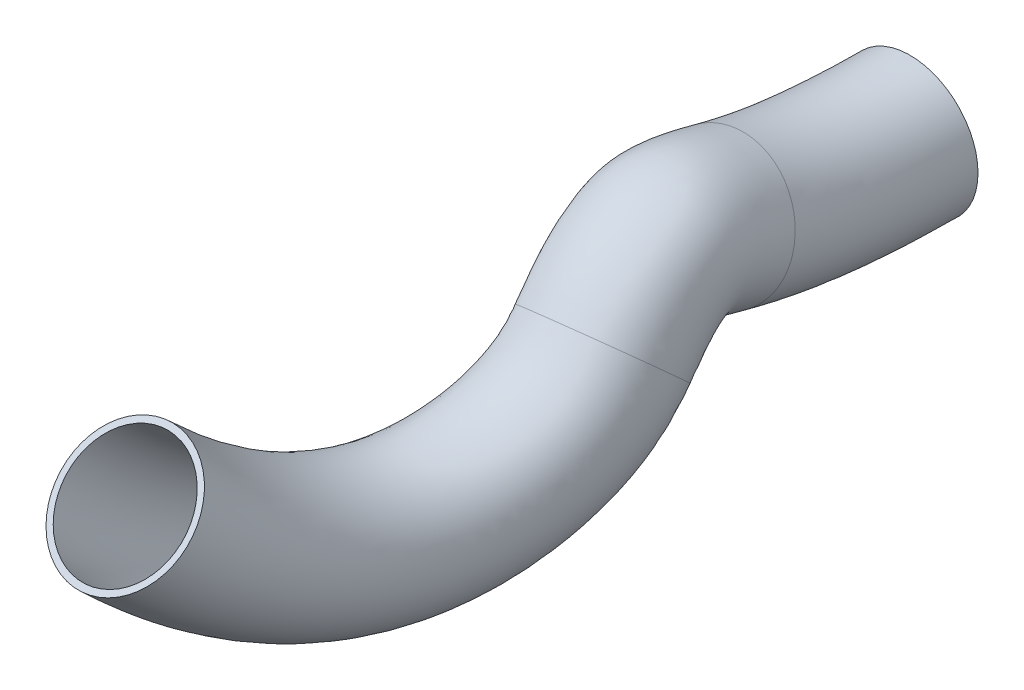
SolidWorks part; units mm, degrees
ref_plane "Front Plane" through (0, 0, 0) normal (0, 0, 1) x (1, 0, 0)
ref_plane "Top Plane" through (0, 0, 0) normal (0, 1, 0) x (1, 0, 0)
ref_plane "Right Plane" through (0, 0, 0) normal (1, 0, 0) x (0, 0, -1)
sketch "Sketch1" plane through (0, 0, 0) normal (0, 0, 1) x (1, 0, 0)
  circle A0 centre (0, 0) radius 31.75
  circle A1 centre (0, 0) radius 34.925
  dimension "D1" = 69.85
  dimension "D2" = 63.5
sketch3d "3DSketch1"
  spline S0 degree 3 poles (0, 0, 0) (-3.545, -2.901, 87.9729) (-0.8055, 24.8327, 112.7523) (1.0198, -1.7321, 157.7244) (7.4447, -41.902, 167.3497) (-16.8128, -73.9378, 289.1024) (-31.8497, 3.9945, 371.7562) knots 0 0 0 0 0.255453 0.318012 0.62558 1 1 1 1
sweep "Sweep1" add profiles "Sketch1" path "3DSketch1"
